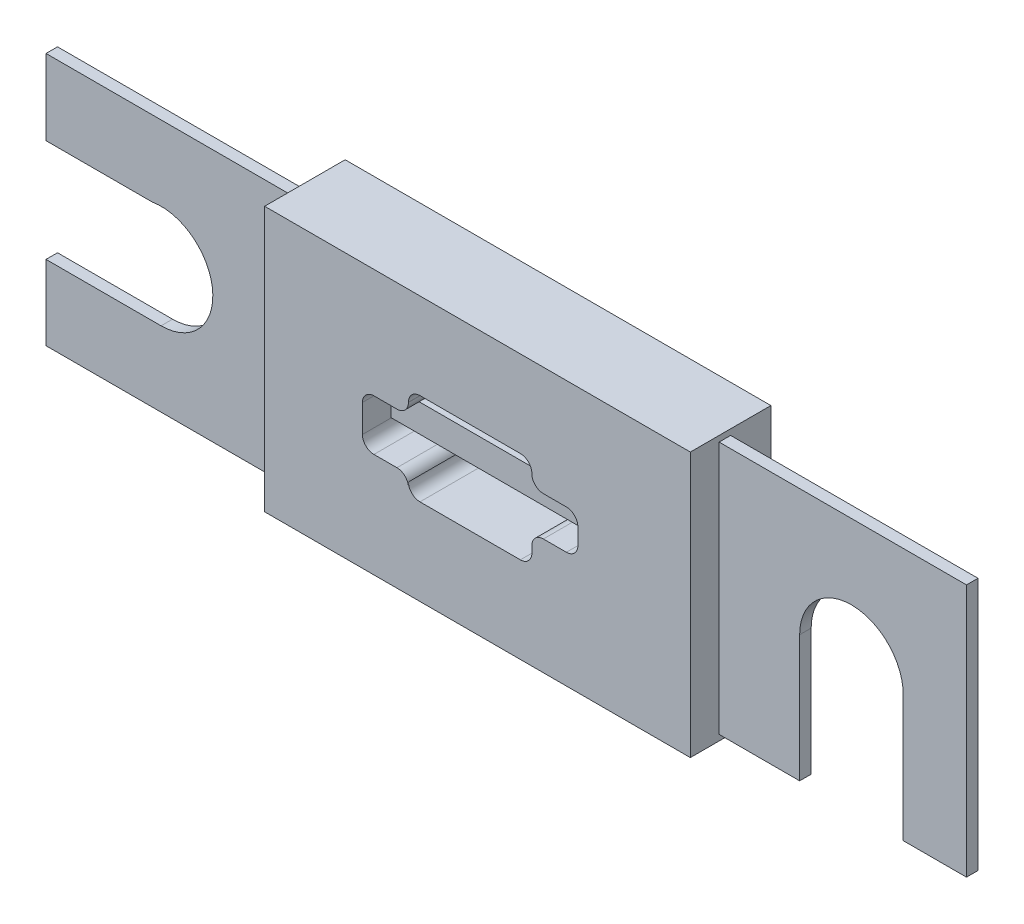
SolidWorks part; units mm, degrees
ref_plane "Plan1" through (0, 0, 0) normal (0, 0, 1) x (1, 0, 0)
ref_plane "Plan2" through (0, 0, 0) normal (0, 1, 0) x (1, 0, 0)
ref_plane "Plan3" through (0, 0, 0) normal (1, 0, 0) x (0, 0, -1)
sketch "Esquisse1" plane through (0, 0, 0) normal (0, 0, 1) x (1, 0, 0)
  line L0 (-10, 4.4338) -> (-0.7689, 4.4338)
  line L1 (-10, 11) -> (12, 11)
  line L2 (-10, 11) -> (-10, 4.4338)
  line L3 (-10, -11) -> (12, -11)
  line L4 (70, 11) -> (70, -11)
  line L5 (0, -4.5) -> (-10, -4.5)
  line L6 (55.5, 0) -> (55.5, -11)
  line L7 (64.5, 0) -> (64.5, -11)
  line L8 (-10, -4.5) -> (-10, -11)
  line L9 (64.5, -11) -> (70, -11)
  line L10 (18, 1) -> (42, 1)
  line L11 (18, -1.4174) -> (42, -1.4174)
  line L12 (15, 4) -> (15, 8)
  line L13 (15, -4.4174) -> (15, -8)
  line L14 (45, 4) -> (45, 8)
  line L15 (45, -4.4174) -> (45, -8)
  line L16 (48, -11) -> (55.5, -11)
  line L17 (48, 11) -> (70, 11)
  arc A0 (0, -4.5) -> (-0.7689, 4.4338) centre (0, 0) ccw
  arc A1 (64.5, 0) -> (55.5, 0) centre (60, 0) ccw
  arc A2 (18, 1) -> (15, 4) centre (18, 4) cw
  arc A3 (15, 8) -> (12, 11) centre (12, 8) ccw
  arc A4 (12, -11) -> (15, -8) centre (12, -8) ccw
  arc A5 (15, -4.4174) -> (18, -1.4174) centre (18, -4.4174) cw
  arc A6 (45, -4.4174) -> (42, -1.4174) centre (42, -4.4174) ccw
  arc A7 (48, -11) -> (45, -8) centre (48, -8) cw
  arc A8 (42, 1) -> (45, 4) centre (42, 4) ccw
  arc A9 (45, 8) -> (48, 11) centre (48, 8) cw
  point P35 (45, -11)
  point P40 (45, 11)
  dimension "D3" = 9
  dimension "D9" = 3
  dimension "D1" = 80
  dimension "D2" = 22
  dimension "D4" = 60
  dimension "D5" = 10
  dimension "D6" = 1
  dimension "D7" = 2.4174
  dimension "D8" = 11
  dimension "D10" = 25
  dimension "D11" = 30
extrude "Base-Extrusion" add sketch "Esquisse1" along normal blind 1
sketch "Esquisse2" plane through (0, 0, 0) normal (0, 0, 1) x (1, 0, 0)
  line L0 (-10, 11) -> (-10, 4.4338) construction
  line L1 (11.5, 11.5) -> (48.5, 11.5)
  line L2 (11.5, 11.5) -> (11.5, -11.5)
  line L3 (11.5, -11.5) -> (48.5, -11.5)
  line L4 (48.5, 11.5) -> (48.5, -11.5)
  line L5 (21, 1.9814) -> (23, 1.9814)
  line L6 (25, 4) -> (33.7262, 4)
  line L7 (20, 0.9814) -> (20, -1.4297)
  line L8 (25, -4) -> (33.7262, -4)
  line L9 (38.7262, 0.9814) -> (38.7262, -0.4297)
  line L10 (21, -2.4297) -> (23, -2.4297)
  line L11 (24, -3.4297) -> (24, -3)
  line L12 (24, 2.9814) -> (24, 3)
  line L13 (34.7262, 3) -> (34.7262, 2.9814)
  line L14 (35.7262, 1.9814) -> (37.7262, 1.9814)
  line L15 (34.7262, -2.4297) -> (34.7262, -3)
  line L16 (35.7262, -1.4297) -> (37.7262, -1.4297)
  arc A0 (20, 0.9814) -> (21, 1.9814) centre (21, 0.9814) cw
  arc A1 (21, -2.4297) -> (20, -1.4297) centre (21, -1.4297) cw
  arc A2 (24, -3.4297) -> (23, -2.4297) centre (23, -3.4297) ccw
  arc A3 (23, 1.9814) -> (24, 2.9814) centre (23, 2.9814) ccw
  arc A4 (35.7262, 1.9814) -> (34.7262, 2.9814) centre (35.7262, 2.9814) cw
  arc A5 (38.7262, 0.9814) -> (37.7262, 1.9814) centre (37.7262, 0.9814) ccw
  arc A6 (37.7262, -1.4297) -> (38.7262, -0.4297) centre (37.7262, -0.4297) ccw
  arc A7 (34.7262, -2.4297) -> (35.7262, -1.4297) centre (35.7262, -2.4297) cw
  arc A8 (25, 4) -> (24, 3) centre (25, 3) ccw
  arc A9 (34.7262, 3) -> (33.7262, 4) centre (33.7262, 3) ccw
  arc A10 (25, -4) -> (24, -3) centre (25, -3) cw
  arc A11 (34.7262, -3) -> (33.7262, -4) centre (33.7262, -3) cw
  point P9 (20, 1.9814)
  point P28 (24, 1.9814)
  point P31 (34.7262, 1.9814)
  point P34 (38.7262, 1.9814)
  dimension "D12" = 1
  dimension "D13" = 1
  dimension "D1" = 37
  dimension "D2" = 21.5
  dimension "D3" = 23
  dimension "D4" = 11.5
  dimension "D5" = 8
  dimension "D6" = 7.5
  dimension "D7" = 8.5
  dimension "D8" = 4.4111
  dimension "D9" = 4
  dimension "D10" = 4
  dimension "D11" = 2.0186
  dimension "D14" = 1.5703
extrude "Boss.-Extru.1" add sketch "Esquisse2" along normal mid plane 7
